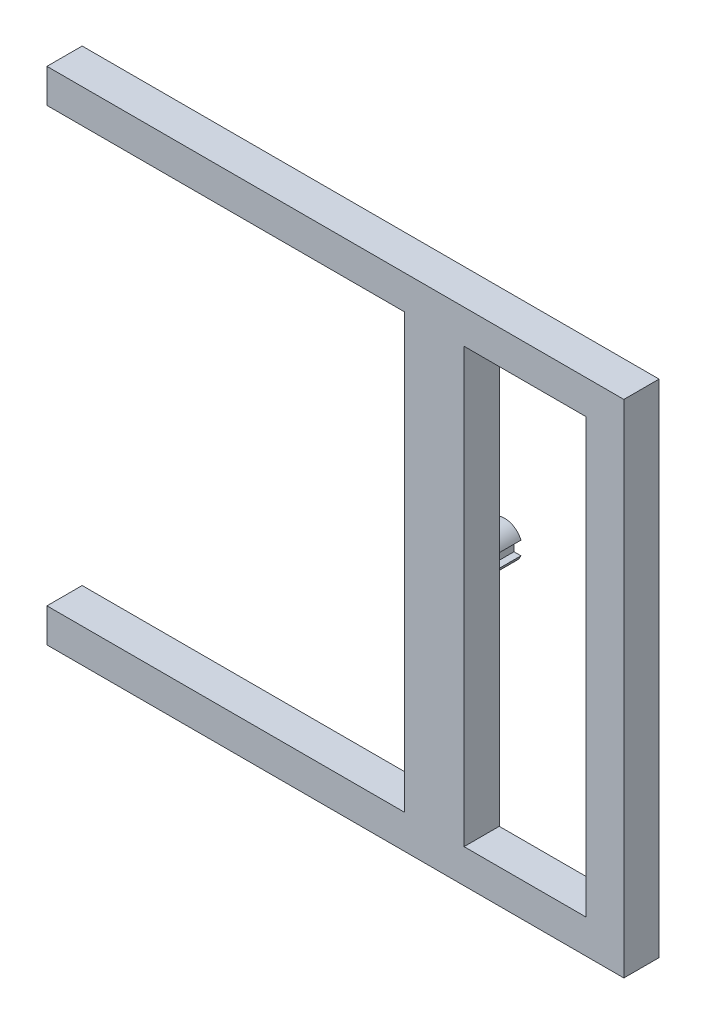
SolidWorks part; units mm, degrees
ref_plane "Plan de face" through (0, 0, 0) normal (0, 0, 1) x (1, 0, 0)
ref_plane "Plan de dessus" through (0, 0, 0) normal (0, 1, 0) x (1, 0, 0)
ref_plane "Plan de droite" through (0, 0, 0) normal (1, 0, 0) x (0, 0, -1)
sketch "Esquisse1" plane through (0, 0, 0) normal (0, 0, 1) x (1, 0, 0)
  line L0 (308, 0) -> (398, 0)
  line L1 (0, 0) -> (264, 0)
  line L2 (0, 0) -> (0, 25)
  line L3 (0, 25) -> (426, 25)
  line L4 (426, 0) -> (426, 25)
  line L5 (264, -320) -> (0, -320)
  line L6 (426, 0) -> (426, -320)
  line L8 (398, 0) -> (398, -320)
  line L9 (398, -320) -> (308, -320)
  line L10 (426, -320) -> (426, -345)
  line L11 (426, -345) -> (0, -345)
  line L12 (0, -320) -> (0, -345)
  line L14 (308, 0) -> (308, -320)
  line L16 (264, 0) -> (264, -320)
  dimension "D1" = 426
  dimension "D2" = 25
  dimension "D5" = 28
  dimension "D6" = 44
  dimension "D7" = 90
  dimension "D8" = 426
extrude "Extrusion1" add sketch "Esquisse1" along normal blind 26
shell "Coque1" thickness 2
sketch "Esquisse2" plane through (0, 0, 0) normal (0, 0, -1) x (-1, 0, 0)
  line L0 (-426, 25) -> (0, 25) construction
  line L1 (0, -345) -> (-426, -345) construction
  line L2 (-308, 0) -> (-308, -320) construction
  line L4 (-298, -155) -> (-292.866, -155)
  line L6 (-298, -165) -> (-292.866, -165)
  line L7 (-292.866, -155) -> (-292.866, -165)
  arc A0 (-298, -165) -> (-298, -155) centre (-286, -160) ccw
  dimension "D1" = 26
  dimension "D2" = 185
  dimension "D3" = 185
  dimension "D4" = 22
  dimension "D5" = 10
  dimension "D6" = 5
extrude "Extrusion2" add sketch "Esquisse2" along normal blind 26
